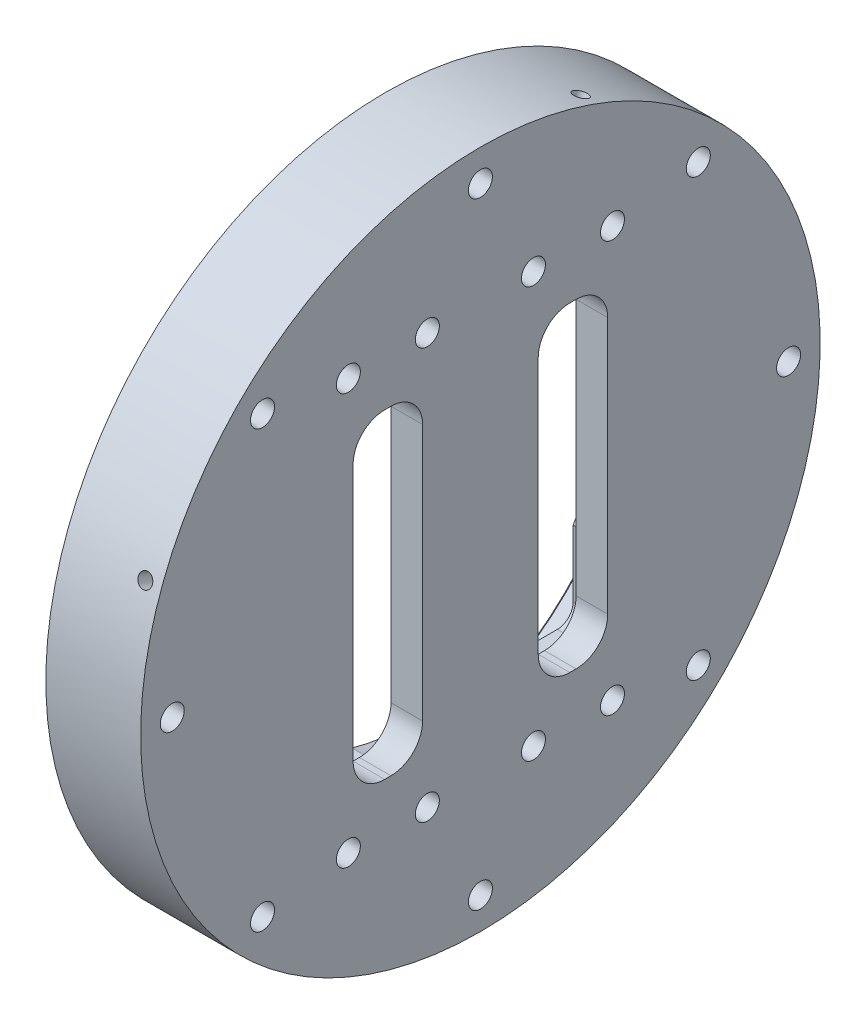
SolidWorks part; units mm, degrees
ref_plane "Front" through (0, 0, 0) normal (0, 0, 1) x (1, 0, 0)
ref_plane "Top" through (0, 0, 0) normal (0, 1, 0) x (1, 0, 0)
ref_plane "Right" through (0, 0, 0) normal (1, 0, 0) x (0, 0, -1)
sketch "Sketch1" plane through (0, 0, 0) normal (0, 0, 1) x (1, 0, 0)
  line L0 (-7.2585, 0) -> (0, 0) construction
  line L1 (0, 68.2625) -> (0, -68.2625) construction
  line L2 (0, 68.2625) -> (19.05, 68.2625)
  line L4 (12.7, 0) -> (19.05, 0)
  line L6 (0.508, 50.9905) -> (0, 51.4985)
  line L7 (4.3434, 39.6875) -> (12.7, 39.6875)
  line L8 (19.05, 68.2625) -> (19.05, 0)
  line L11 (4.3434, 50.9905) -> (0.508, 50.9905)
  line L12 (0, 68.2625) -> (0, 51.4985)
  line L13 (12.7, 39.6875) -> (12.7, 0)
  line L15 (4.3434, 50.9905) -> (4.3434, 39.6875)
  point P11 (0, 50.9905)
  dimension "D1" = 0.508
  dimension "D2" = 136.525
  dimension "D4" = 19.05
  dimension "D5" = 79.375
  dimension "D6" = 4.3434
  dimension "D7" = 6.35
  dimension "D10" = 101.981
revolve "Revolve1" add sketch "Sketch1" angle 360 about L0
sketch "Sketch2" plane through (0, 0, 0) normal (0, 0, 1) x (1, 0, 0)
  line L0 (4.3434, 39.6875) -> (4.3434, 50.9905)
  line L1 (4.3434, 39.6875) -> (4.3434, 50.9905)
  line L2 (19.05, 68.2625) -> (19.05, -68.2625)
  line L3 (19.05, 68.2625) -> (19.05, -68.2625)
  line L4 (4.3434, 0) -> (19.05, 0)
  line L6 (4.3434, -50.9905) -> (4.3434, -39.6875)
  line L7 (4.3434, -50.9905) -> (4.3434, -39.6875)
  point P0 (11.6967, 0)
ref_plane "MID Plane" through (11.6967, 0, 0) normal (1, 0, 0) x (0, 0, -1)
ref_plane "Plane2" through (15.875, 0, 0) normal (1, 0, 0) x (0, 0, -1)
sketch "Sketch3" plane through (19.05, 0, 0) normal (1, 0, 0) x (0, 0, -1)
  line L1 (-19.2313, 32.1437) -> (-17.9613, 32.1437)
  line L2 (-25.5813, 25.7937) -> (-25.5813, -25.7937)
  line L3 (-19.2313, -32.1437) -> (-17.9613, -32.1437)
  line L4 (-11.6113, 25.7937) -> (-11.6113, -25.7937)
  line L5 (-23.2, 20.3835) -> (-23.2, -20.3835) construction
  line L6 (17.9613, 32.1437) -> (19.2313, 32.1437)
  line L7 (11.6113, 25.7937) -> (11.6113, -25.7937)
  line L8 (17.9613, -32.1437) -> (19.2313, -32.1437)
  line L9 (25.5813, 25.7937) -> (25.5813, -25.7937)
  line L10 (23.2, -20.3835) -> (23.2, 20.3835) construction
  arc A0 (-19.2313, 32.1437) -> (-25.5813, 25.7937) centre (-19.2313, 25.7937) ccw
  arc A1 (-17.9613, 32.1437) -> (-11.6113, 25.7937) centre (-17.9613, 25.7937) cw
  arc A2 (-25.5813, -25.7937) -> (-19.2313, -32.1437) centre (-19.2313, -25.7937) ccw
  arc A3 (-17.9613, -32.1437) -> (-11.6113, -25.7937) centre (-17.9613, -25.7937) ccw
  arc A4 (17.9613, 32.1437) -> (11.6113, 25.7937) centre (17.9613, 25.7937) ccw
  arc A5 (19.2313, 32.1437) -> (25.5813, 25.7937) centre (19.2313, 25.7937) cw
  arc A6 (11.6113, -25.7937) -> (17.9613, -32.1437) centre (17.9613, -25.7937) ccw
  arc A7 (19.2313, -32.1437) -> (25.5813, -25.7937) centre (19.2313, -25.7937) ccw
  point P15 (-25.5813, 32.1437)
  point P18 (-11.6113, 32.1437)
  point P21 (-25.5813, -32.1437)
  dimension "D6" = 6.35
  dimension "D1" = 13.97
  dimension "D2" = 2.3813
  dimension "D3" = 64.2874
  dimension "D4" = 32.1437
  dimension "D5" = 2.3813
extrude "Cut-Extrude1" cut sketch "Sketch3" against normal through all
sketch "Sketch5" plane through (15.875, 0, 0) normal (1, 0, 0) x (0, 0, -1)
  circle A0 centre (0, 0) radius 68.2625 construction
  point P0 (0, 0)
hole_wizard "#4-40 Tapped Hole1" positions "3DSketch1" profile "Sketch14" tap size "#4-40" standard "Ansi Inch"
sketch3d "3DSketch1"
  line L0 (15.875, 0, 0) -> (15.875, 64.1458, -23.3472)
  line L2 (15.875, 0, 0) -> (15.875, -23.3472, -64.1458)
  line L4 (15.875, 0, 0) -> (15.875, 82.0981, 0)
  point P0 (15.875, 23.3472, 64.1458)
  point P6 (15.875, -23.3472, -64.1458)
  point P8 (15.875, 64.1458, -23.3472)
  point P10 (15.875, -64.1458, 23.3472)
  dimension "D1" = 20
  dimension "D2" = 90
sketch "Sketch14" plane through (15.875, 23.3472, 64.1458) normal (1, 0, 0) x (0, -0.9397, 0.342)
  line L0 (0, 0) -> (0, 8.2738)
  line L1 (0, 8.2738) -> (1.1303, 7.5946)
  line L2 (1.1303, 7.5946) -> (1.1303, 5.6896)
  line L3 (1.1303, 5.6896) -> (1.4224, 5.6896)
  line L4 (1.4224, 5.6896) -> (1.4224, 0)
  line L5 (1.4224, 0) -> (0, 0)
  line L10 (0, 8.2738) -> (-1.1303, 7.5946) construction
  line L11 (0, -6.35) -> (0, 107.95) construction
  dimension "Tap Drill Dia." = 2.2606
  dimension "Tap Drill Depth" = 7.5946
  dimension "Thread Major Dia." = 2.8448
  dimension "Thread Depth" = 5.6896
  dimension "Drill Angle" = 118
sketch "Sketch6" plane through (19.05, 0, 0) normal (-1, 0, 0) x (0, 0, 1)
  line L0 (-17.9613, -32.1437) -> (-19.2313, -32.1437) construction
  line L1 (-31.2963, 46.0375) -> (-5.8963, 46.0375)
  line L2 (-31.2963, 46.0375) -> (-31.2963, -46.0375)
  line L3 (-31.2963, -46.0375) -> (-5.8963, -46.0375)
  line L4 (-5.8963, 46.0375) -> (-5.8963, -46.0375)
  line L5 (0, 0) -> (0, -12.4013) construction
  line L6 (5.8963, 46.0375) -> (5.8963, -46.0375)
  line L7 (31.2963, -46.0375) -> (5.8963, -46.0375)
  line L8 (31.2963, 46.0375) -> (31.2963, -46.0375)
  line L9 (31.2963, 46.0375) -> (5.8963, 46.0375)
  point P7 (-18.5963, -32.1437)
  point P8 (-26.5338, 41.275)
  point P9 (-10.6588, 41.275)
  point P10 (-10.6588, -41.275)
  point P11 (-26.5338, -41.275)
  point P18 (26.5338, -41.275)
  point P19 (10.6588, -41.275)
  point P20 (10.6588, 41.275)
  point P21 (26.5338, 41.275)
  point P22 (18.5963, -32.1437)
  dimension "D1" = 92.075
  dimension "D2" = 25.4
  dimension "D3" = 46.0375
  dimension "D4" = 12.7
  dimension "D5" = 82.55
  dimension "D6" = 15.875
  dimension "D7" = 7.9375
  dimension "D8" = 41.275
hole_wizard "#10-32 Tapped Hole1" positions "Sketch8" profile "Sketch7" tap size "#10-32" standard "Ansi Inch"
sketch "Sketch8" plane through (19.05, 0, 0) normal (1, 0, 0) x (0, 0, -1)
  point P1 (10.6588, 41.275)
  point P4 (26.5338, 41.275)
  point P7 (26.5338, -41.275)
  point P10 (10.6588, -41.275)
  point P15 (-26.5338, 41.275)
  point P18 (-10.6588, 41.275)
  point P21 (-10.6588, -41.275)
  point P24 (-26.5338, -41.275)
sketch "Sketch7" plane through (19.05, 41.275, -10.6588) normal (0, 1, 0) x (0, 0, -1)
  line L0 (0, 0) -> (0, 13.2428)
  line L1 (0, 13.2428) -> (2.0193, 12.0294)
  line L2 (2.0193, 12.0294) -> (2.0193, 9.652)
  line L3 (2.0193, 9.652) -> (2.413, 9.652)
  line L4 (2.413, 9.652) -> (2.413, 0)
  line L5 (2.413, 0) -> (0, 0)
  line L10 (0, 13.2428) -> (-2.0193, 12.0294) construction
  line L11 (0, -6.35) -> (0, 107.95) construction
  dimension "Tap Drill Dia." = 4.0386
  dimension "Tap Drill Depth" = 12.0294
  dimension "Thread Major Dia." = 4.826
  dimension "Thread Depth" = 9.652
  dimension "Drill Angle" = 118
sketch "Sketch9" plane through (4.3434, 0, 0) normal (-1, 0, 0) x (0, 0, 1)
  line L1 (-30.1625, 38.1) -> (30.1625, 38.1)
  line L2 (-33.3375, 34.925) -> (-33.3375, -34.925)
  line L3 (-30.1625, -38.1) -> (30.1625, -38.1)
  line L4 (33.3375, 34.925) -> (33.3375, -34.925)
  arc A0 (-30.1625, 38.1) -> (-33.3375, 34.925) centre (-30.1625, 34.925) ccw
  arc A1 (30.1625, 38.1) -> (33.3375, 34.925) centre (30.1625, 34.925) cw
  arc A2 (30.1625, -38.1) -> (33.3375, -34.925) centre (30.1625, -34.925) ccw
  arc A3 (-33.3375, -34.925) -> (-30.1625, -38.1) centre (-30.1625, -34.925) ccw
  point P7 (-33.3375, 38.1)
  point P10 (33.3375, 38.1)
  point P15 (-33.3375, -38.1)
  dimension "D5" = 3.175
  dimension "D1" = 66.675
  dimension "D2" = 33.3375
  dimension "D3" = 76.2
  dimension "D4" = 38.1
extrude "Cut-Extrude2" cut sketch "Sketch9" against normal blind 8.3566
hole_wizard "#10-32 Tapped Hole2" positions "Sketch11" profile "Sketch10" tap size "#10-32" standard "Ansi Inch"
sketch "Sketch11" plane through (19.05, 0, 0) normal (1, 0, 0) x (0, 0, -1)
  line L0 (0, 0) -> (43.7787, 43.7787) construction
  line L2 (0, 0) -> (0, 61.9125) construction
  circle A0 centre (0, 0) radius 61.9125 construction
  point P7 (0, 61.9125)
  point P33 (43.7787, 43.7787)
  point P34 (61.9125, 0)
  point P35 (43.7787, -43.7787)
  point P36 (0, -61.9125)
  point P37 (-43.7787, -43.7787)
  point P38 (-61.9125, 0)
  point P39 (-43.7787, 43.7787)
  dimension "D1" = 123.825
  dimension "D2" = 45
sketch "Sketch10" plane through (19.05, 61.9125, 0) normal (0, 1, 0) x (0, 0, -1)
  line L0 (0, 0) -> (0, 19.05)
  line L1 (0, 19.05) -> (2.413, 19.05)
  line L2 (2.413, 19.05) -> (2.413, 0)
  line L5 (2.413, 0) -> (0, 0)
  line L11 (0, -6.35) -> (0, 107.95) construction
  dimension "Thread Major Dia." = 4.826
  dimension "Thru Tap Drill Depth" = 19.05
equation "\"D4@Sketch3\" = \"D3@Sketch3\"/2"
equation "\"D5@Sketch3\" = \"D2@Sketch3\""
equation "\"D3@Sketch6\" = \"D1@Sketch6\"/2"
equation "\"D7@Sketch6\" = \"D6@Sketch6\"/2"
equation "\"D8@Sketch6\" = \"D5@Sketch6\"/2"
equation "\"D2@Sketch9\" = \"D1@Sketch9\"/2"
equation "\"D4@Sketch9\" = \"D3@Sketch9\"/2"
